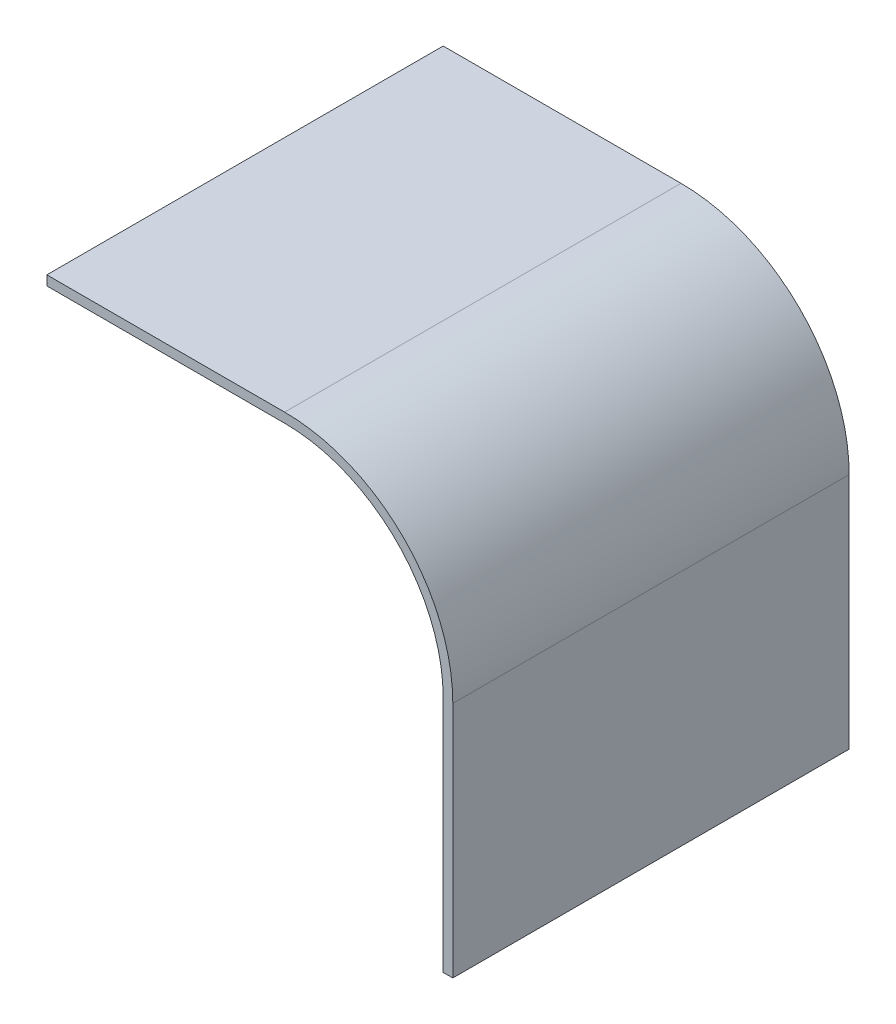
SolidWorks part; units mm, degrees
ref_plane "Front Plane" through (0, 0, 0) normal (0, 0, 1) x (1, 0, 0)
ref_plane "Top Plane" through (0, 0, 0) normal (0, 1, 0) x (1, 0, 0)
ref_plane "Right Plane" through (0, 0, 0) normal (1, 0, 0) x (0, 0, -1)
sketch "Sketch1" plane through (0, 0, 0) normal (0, 0, 1) x (1, 0, 0)
  line L3 (50, -50) -> (50, -20)
  line L4 (30, 0) -> (0, 0)
  arc A1 (50, -20) -> (30, 0) centre (30, -20) ccw
  dimension "D2" = 20
  dimension "D1" = 30
extrude "Extrude-Thin1" add sketch "Sketch1" along normal blind 50 thin
